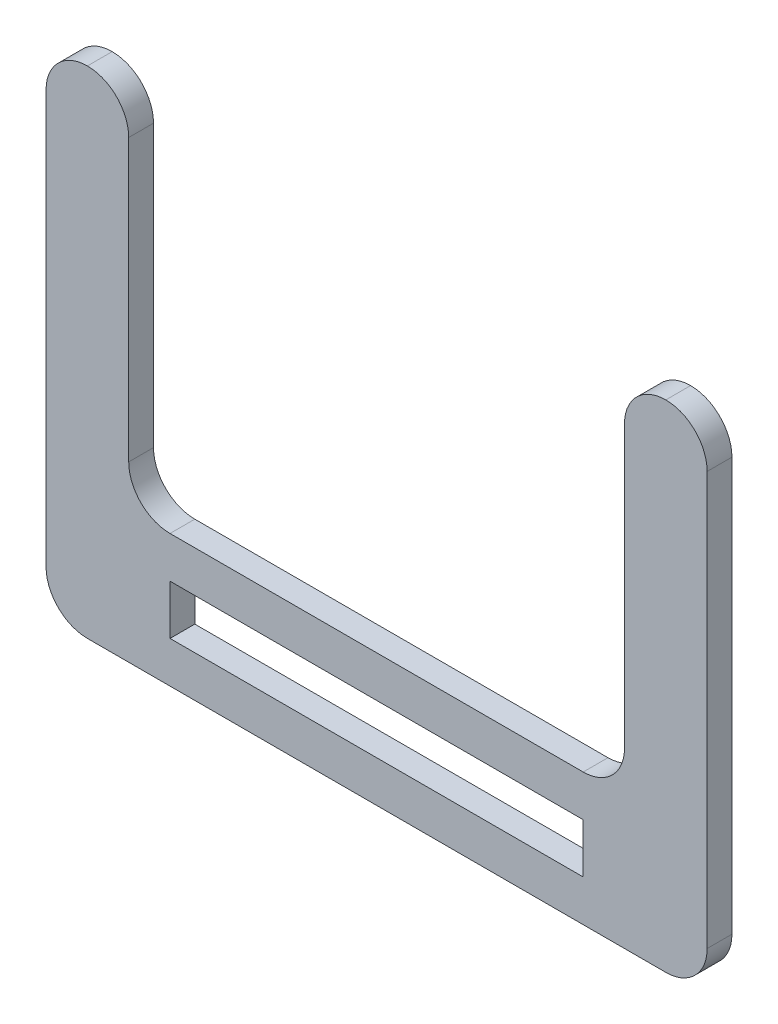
SolidWorks part; units mm, degrees
ref_plane "Plan de face" through (0, 0, 0) normal (0, 0, 1) x (1, 0, 0)
ref_plane "Plan de dessus" through (0, 0, 0) normal (0, 1, 0) x (1, 0, 0)
ref_plane "Plan de droite" through (0, 0, 0) normal (1, 0, 0) x (0, 0, -1)
sketch "Esquisse1" plane through (0, 0, 0) normal (0, 0, 1) x (1, 0, 0)
  line L0 (-63.8455, 55.4954) -> (-53.8455, 55.4954)
  line L2 (-63.8455, -4.5046) -> (-63.8455, 55.4954)
  line L3 (-63.8455, -4.5046) -> (16.1545, -4.5046)
  line L4 (-53.8455, 55.4954) -> (-53.8455, 11.4954)
  line L5 (16.1545, 55.4954) -> (16.1545, -4.5046)
  line L7 (-53.8455, 11.4954) -> (6.1545, 11.4954)
  line L10 (6.1545, 11.4954) -> (6.1545, 55.4954)
  line L11 (6.1545, 55.4954) -> (16.1545, 55.4954)
  dimension "D1" = 10
  dimension "D2" = 60
  dimension "D4" = 80
  dimension "D5" = 10
extrude "Extrusion1" add sketch "Esquisse1" along normal blind 3
sketch "Esquisse2" plane through (0, 0, 3) normal (0, 0, 1) x (1, 0, 0)
  line L0 (-63.8455, -4.5046) -> (16.1545, -4.5046) construction
  line L1 (-48.8455, 6.4954) -> (1.1545, 6.4954)
  line L2 (-48.8455, 6.4954) -> (-48.8455, 0.4954)
  line L3 (-48.8455, 0.4954) -> (1.1545, 0.4954)
  line L4 (1.1545, 6.4954) -> (1.1545, 0.4954)
  line L5 (-63.8455, 55.4954) -> (-63.8455, -4.5046) construction
  dimension "D1" = 5
  dimension "D2" = 6
  dimension "D3" = 15
  dimension "D4" = 50
extrude "Enlèv. mat.-Extru.1" cut sketch "Esquisse2" against normal blind 6
fillet "Congé1" radius 5 12 edges at (-63.8455, 55.4954, 1.5) (-53.8455, 55.4954, 1.5) (-53.8455, 11.4954, 1.5) (6.1545, 11.4954, 1.5) (11.1545, 55.4954, 3) (6.1545, 55.4954, 1.5) (16.1545, 55.4954, 1.5) (16.1545, -4.5046, 1.5) (-63.8455, -4.5046, 1.5) (-58.8455, 55.4954, 3) (-58.8455, 55.4954, 0) (11.1545, 55.4954, 0)
